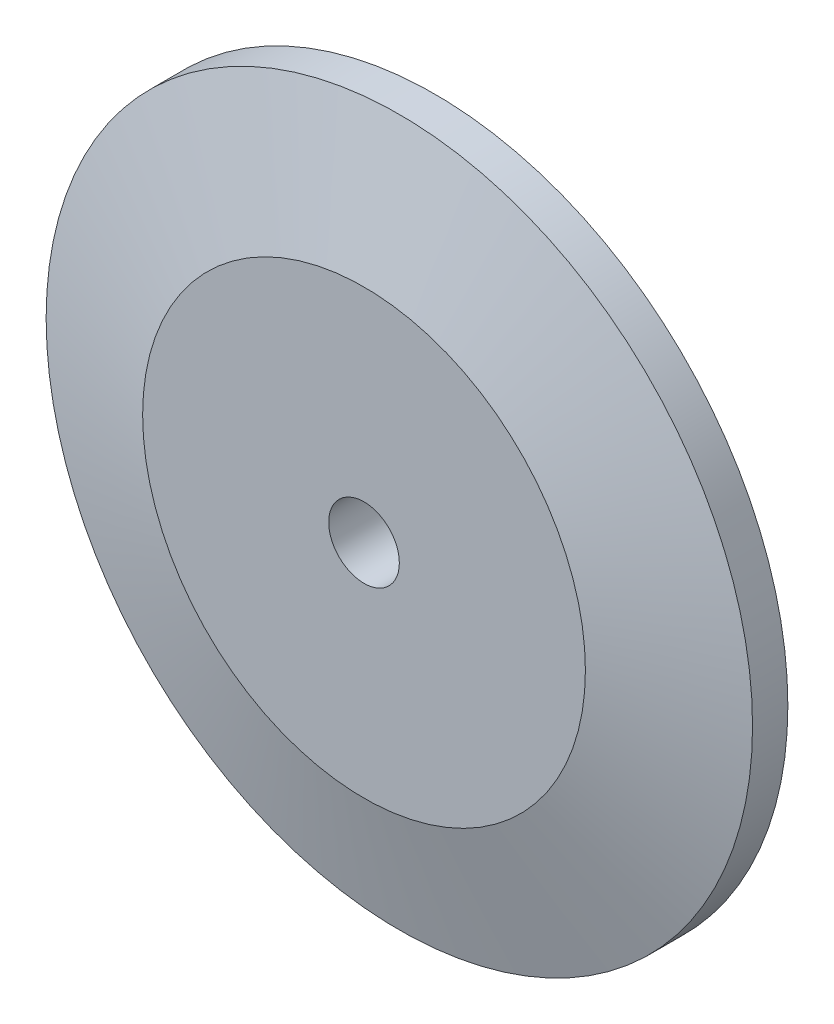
SolidWorks part; units mm, degrees
ref_plane "Front Plane" through (0, 0, 0) normal (0, 0, 1) x (1, 0, 0)
ref_plane "Top Plane" through (0, 0, 0) normal (0, 1, 0) x (1, 0, 0)
ref_plane "Right Plane" through (0, 0, 0) normal (1, 0, 0) x (0, 0, -1)
sketch "Sketch1" plane through (0, 0, 0) normal (0, 0, 1) x (1, 0, 0)
  circle A0 centre (0, 0) radius 25.4
extrude "Boss-Extrude2" add sketch "Sketch1" along normal blind 2.54 contours A0
sketch "Sketch2" plane through (0, 0, 2.54) normal (0, 0, 1) x (1, 0, 0)
  circle A1 centre (0, 0) radius 25.4
  circle A2 centre (0, 0) radius 25.4
  dimension "D1" = 0
extrude "Boss-Extrude3" add sketch "Sketch2" along normal blind 2.54 draft 75
sketch "Sketch3" plane through (0, 0, 0) normal (0, 0, -1) x (-1, 0, 0)
  circle A0 centre (0, 0) radius 2.54
extrude "Boss-Extrude4" add sketch "Sketch3" along normal blind 8.89
sketch "Sketch4" plane through (0, 0, -8.89) normal (0, 0, -1) x (-1, 0, 0)
  circle A1 centre (0, 0) radius 2.54
  circle A2 centre (0, 0) radius 2.54
  dimension "D1" = 0
extrude "Boss-Extrude5" add sketch "Sketch4" along normal blind 2.54
sketch "Sketch5" plane through (0, 0, -11.43) normal (0, 0, -1) x (-1, 0, 0)
  circle A1 centre (0, 0) radius 2.54
  circle A2 centre (0, 0) radius 2.54
  dimension "D1" = 0
extrude "Cut-Extrude1" cut sketch "Sketch5" against normal up to surface (11.43 mm away)
sketch "Sketch6" plane through (0, 0, 5.08) normal (0, 0, 1) x (1, 0, 0)
  circle A0 centre (0, 0) radius 2.54
extrude "Cut-Extrude2" cut sketch "Sketch6" against normal blind 14.224
